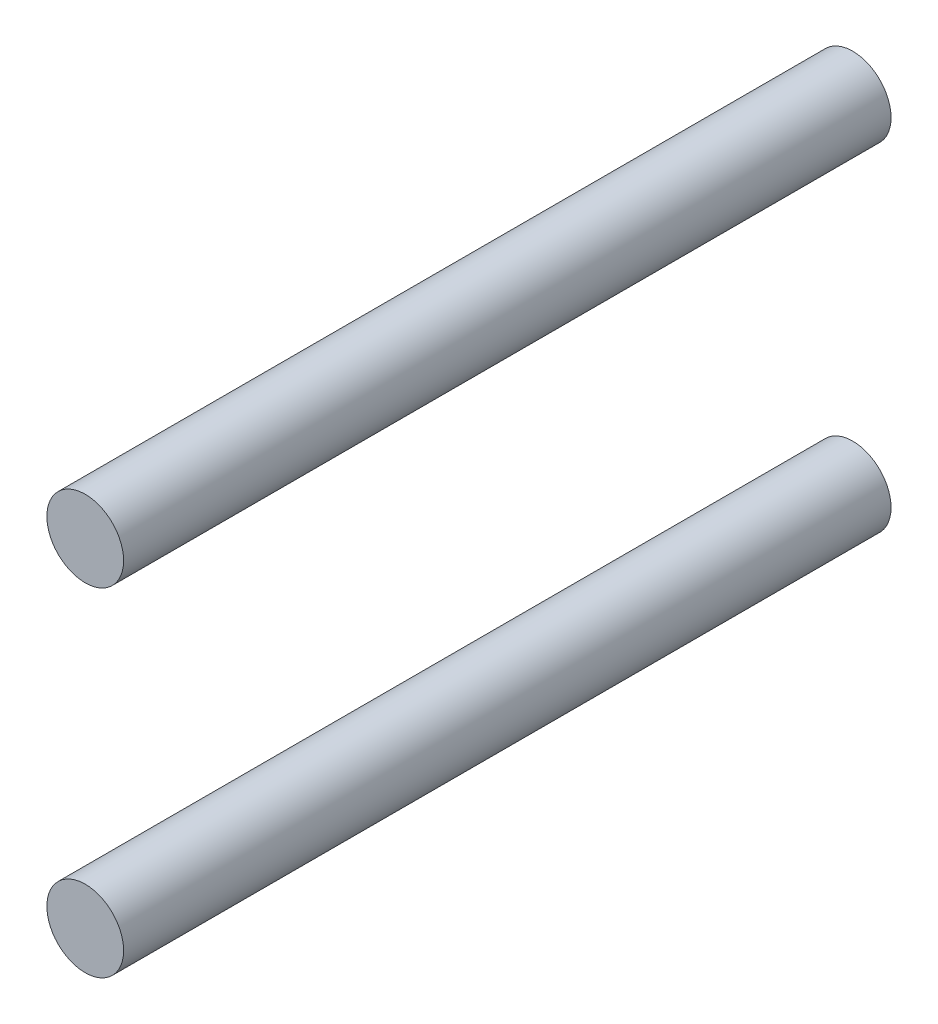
SolidWorks part; units mm, degrees
ref_plane "前视基准面" through (0, 0, 0) normal (0, 0, 1) x (1, 0, 0)
ref_plane "上视基准面" through (0, 0, 0) normal (0, 1, 0) x (1, 0, 0)
ref_plane "右视基准面" through (0, 0, 0) normal (1, 0, 0) x (0, 0, -1)
sketch "草图1" plane through (0, 0, 0) normal (0, 0, 1) x (1, 0, 0)
  line L0 (0, 14.7384) -> (0, -15.9941) construction
  circle A1 centre (0, 12) radius 2.5
  circle A2 centre (0, -10) radius 2.5
  dimension "D1" = 22
  dimension "D2" = 5
  dimension "D3" = 5
extrude "凸台-拉伸1" add sketch "草图1" along normal blind 50
